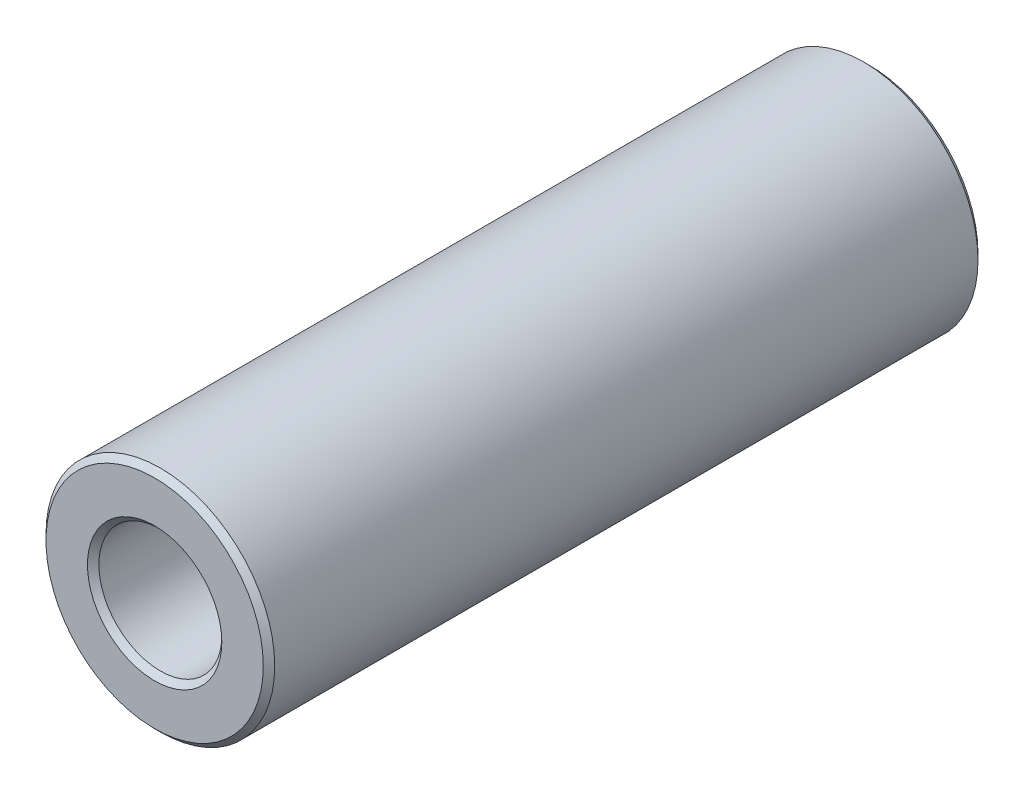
SolidWorks part; units mm, degrees
ref_plane "Front Plane" through (0, 0, 0) normal (0, 0, 1) x (1, 0, 0)
ref_plane "Top Plane" through (0, 0, 0) normal (0, 1, 0) x (1, 0, 0)
ref_plane "Right Plane" through (0, 0, 0) normal (1, 0, 0) x (0, 0, -1)
sketch "Sketch1" plane through (0, 0, 0) normal (0, 0, 1) x (1, 0, 0)
  circle A0 centre (0, 0) radius 4
  circle A1 centre (0, 0) radius 2.15
  dimension "D1" = 8
  dimension "D2" = 4.3
extrude "Boss-Extrude2" add sketch "Sketch1" along normal mid plane 25
chamfer "Chamfer3" distance 0.2 angle 45 4 edges at (4, 0, 12.5) (4, 0, -12.5) (2.15, 0, -12.5) (2.15, 0, 12.5)
